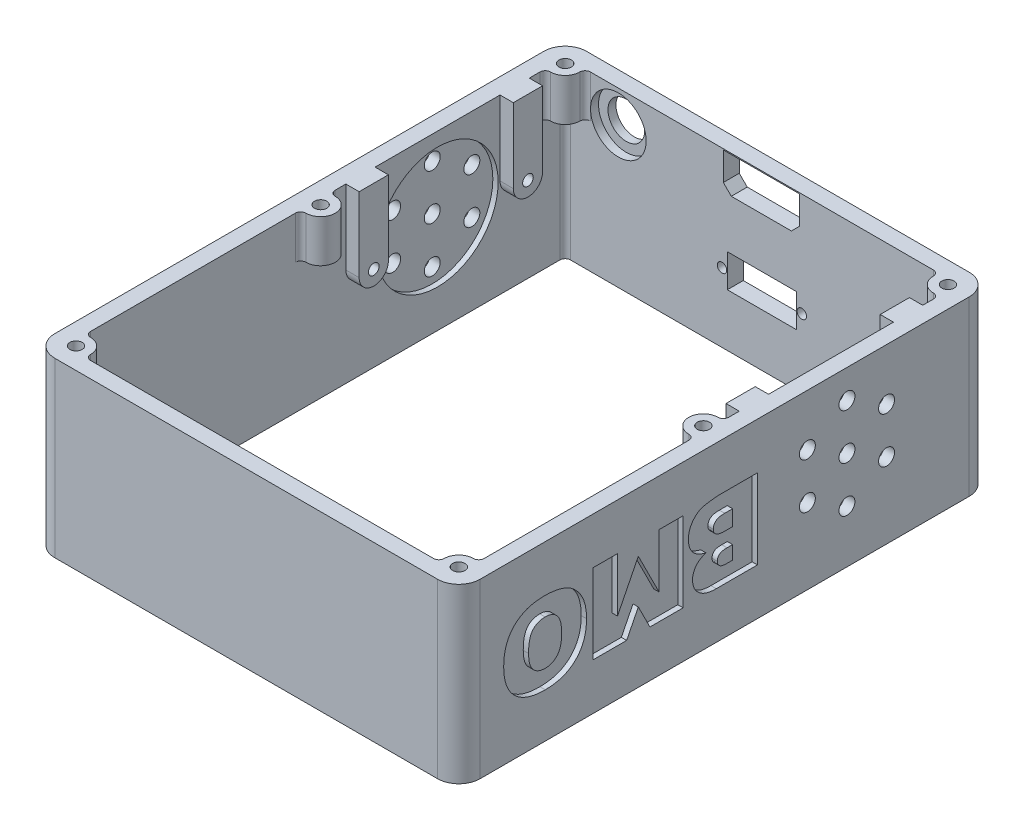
SolidWorks part; units mm, degrees
ref_plane "Front Plane" through (0, 0, 0) normal (0, 0, 1) x (1, 0, 0)
ref_plane "Top Plane" through (0, 0, 0) normal (0, 1, 0) x (1, 0, 0)
ref_plane "Right Plane" through (0, 0, 0) normal (1, 0, 0) x (0, 0, -1)
sketch "Sketch1" plane through (0, 0, 0) normal (0, 1, 0) x (1, 0, 0)
  line L0 (-46.99, 58.42) -> (-46.99, -58.42)
  line L1 (-45.72, -59.69) -> (45.72, -59.69)
  line L2 (46.99, -58.42) -> (46.99, 58.42)
  line L3 (45.72, 59.69) -> (-45.72, 59.69)
  line L4 (45.72, 63.5) -> (-45.72, 63.5)
  line L5 (-50.8, 58.42) -> (-50.8, -58.42)
  line L6 (-45.72, -63.5) -> (45.72, -63.5)
  line L7 (50.8, -58.42) -> (50.8, 58.42)
  line L8 (45.72, 63.5) -> (-45.72, 63.5)
  line L9 (-50.8, 58.42) -> (-50.8, -58.42)
  line L10 (-45.72, -63.5) -> (45.72, -63.5)
  line L11 (50.8, -58.42) -> (50.8, 58.42)
  arc A0 (-45.72, 59.69) -> (-46.99, 58.42) centre (-45.72, 58.42) ccw
  arc A1 (-46.99, -58.42) -> (-45.72, -59.69) centre (-45.72, -58.42) ccw
  arc A2 (45.72, -59.69) -> (46.99, -58.42) centre (45.72, -58.42) ccw
  arc A3 (46.99, 58.42) -> (45.72, 59.69) centre (45.72, 58.42) ccw
  arc A4 (50.8, 58.42) -> (45.72, 63.5) centre (45.72, 58.42) ccw
  arc A5 (-45.72, 63.5) -> (-50.8, 58.42) centre (-45.72, 58.42) ccw
  arc A6 (-50.8, -58.42) -> (-45.72, -63.5) centre (-45.72, -58.42) ccw
  arc A7 (45.72, -63.5) -> (50.8, -58.42) centre (45.72, -58.42) ccw
  arc A8 (50.8, 58.42) -> (45.72, 63.5) centre (45.72, 58.42) ccw
  arc A9 (-45.72, 63.5) -> (-50.8, 58.42) centre (-45.72, 58.42) ccw
  arc A10 (-50.8, -58.42) -> (-45.72, -63.5) centre (-45.72, -58.42) ccw
  arc A11 (45.72, -63.5) -> (50.8, -58.42) centre (45.72, -58.42) ccw
  dimension "D1" = 0
  dimension "D2" = 3.81
extrude "Boss-Extrude1" add sketch "Sketch1" along normal blind 41.275
sketch "Sketch2" plane through (0, 41.275, 0) normal (0, 1, 0) x (1, 0, 0)
  circle A0 centre (-45.72, 58.42) radius 3.4925
  circle A1 centre (45.72, 58.42) radius 3.4925
  circle A2 centre (-45.72, -58.42) radius 3.4925
  circle A3 centre (45.72, -58.42) radius 3.4925
  circle A4 centre (-45.72, 0) radius 3.4925
  circle A5 centre (45.72, 0) radius 3.4925
  dimension "D1" = 6.985
extrude "Boss-Extrude2" add sketch "Sketch2" against normal blind 10.16
hole_wizard "#4 Clearance Hole1" positions "Sketch4" profile "Sketch3" hole size "#4" standard "ANSI Inch"
sketch "Sketch4" plane through (0, 41.275, 0) normal (0, 1, 0) x (1, 0, 0)
  point P0 (-45.72, 58.42)
  point P3 (45.72, 58.42)
  point P6 (-45.72, 0)
  point P9 (45.72, 0)
  point P12 (-45.72, -58.42)
  point P15 (45.72, -58.42)
sketch "Sketch3" plane through (-45.72, 41.275, -58.42) normal (1, 0, 0) x (0, 0, 1)
  line L0 (0, 0) -> (0, 8.5052)
  line L1 (0, 8.5052) -> (1.4732, 7.62)
  line L2 (1.4732, 7.62) -> (1.4732, 0)
  line L5 (1.4732, 0) -> (0, 0)
  line L10 (0, 8.5052) -> (-1.4732, 7.62) construction
  line L11 (0, -6.35) -> (0, 107.95) construction
  dimension "Hole Dia." = 2.9464
  dimension "Hole Depth" = 7.62
  dimension "Drill Angle" = 118
fillet "Fillet1" radius 1.27 12 edges at (46.99, 36.195, -55.1666) (42.4666, 36.195, -59.69) (-42.4666, 36.195, -59.69) (-46.99, 36.195, -55.1666) (-46.99, 36.195, -3.2534) (-46.99, 36.195, 3.2534) (-46.99, 36.195, 55.1666) (-42.4666, 36.195, 59.69) (42.4666, 36.195, 59.69) (46.99, 36.195, 55.1666) (46.99, 36.195, 3.2534) (46.99, 36.195, -3.2534)
sketch "Sketch5" plane through (-46.99, 0, 0) normal (1, 0, 0) x (0, 0, -1)
  circle A2 centre (29.21, 23.495) radius 14.478
  circle A3 centre (29.21, 23.495) radius 14.478
  dimension "D1" = 0.508
extrude "Cut-Extrude1" cut sketch "Sketch5" against normal blind 1.27
sketch "Sketch6" plane through (-46.99, 0, 0) normal (1, 0, 0) x (0, 0, -1)
  line L0 (29.21, 23.495) -> (29.21, 41.275) construction
  line L1 (53.6575, 41.275) -> (4.7625, 41.275) construction
  line L2 (10.795, 41.275) -> (10.795, 23.495) construction
  line L3 (7.3025, 41.275) -> (14.2875, 41.275)
  line L4 (7.3025, 41.275) -> (7.3025, 23.495)
  line L5 (7.3025, 41.275) -> (7.3025, 23.495)
  line L6 (14.2875, 41.275) -> (14.2875, 23.495)
  line L7 (14.2875, 41.275) -> (14.2875, 23.495)
  line L8 (7.3025, 41.275) -> (7.3025, 23.495)
  line L9 (7.3025, 41.275) -> (7.3025, 23.495)
  line L10 (14.2875, 41.275) -> (14.2875, 23.495)
  line L11 (14.2875, 41.275) -> (14.2875, 23.495)
  line L12 (51.1175, 41.275) -> (51.1175, 23.495)
  line L13 (51.1175, 41.275) -> (44.1325, 41.275)
  line L14 (44.1325, 41.275) -> (44.1325, 23.495)
  arc A0 (7.3025, 23.495) -> (14.2875, 23.495) centre (10.795, 23.495) ccw
  arc A1 (51.1175, 23.495) -> (44.1325, 23.495) centre (47.625, 23.495) cw
  dimension "D1" = 6.985
  dimension "D2" = 18.415
extrude "Boss-Extrude3" add sketch "Sketch6" along normal blind 3.175 contours A1 L12 L14 M4 | L4 A0 L6 M4
hole_wizard "#4 Clearance Hole2" positions "Sketch8" profile "Sketch7" hole size "#4" standard "ANSI Inch"
sketch "Sketch8" plane through (-43.815, 0, 0) normal (1, 0, 0) x (0, 0, -1)
  point P0 (10.795, 23.495)
  point P3 (47.625, 23.495)
sketch "Sketch7" plane through (-43.815, 23.495, -10.795) normal (0, 1, 0) x (0, 0, -1)
  line L0 (0, 0) -> (0, 5.8431)
  line L1 (0, 5.8431) -> (1.27, 5.08)
  line L2 (1.27, 5.08) -> (1.27, 0)
  line L5 (1.27, 0) -> (0, 0)
  line L10 (0, 5.8431) -> (-1.27, 5.08) construction
  line L11 (0, -6.35) -> (0, 107.95) construction
  dimension "Hole Dia." = 2.54
  dimension "Hole Depth" = 5.08
  dimension "Drill Angle" = 118
mirror "Mirror2" about plane through (0, 0, 0) normal (1, 0, 0) of "#4 Clearance Hole2", "Boss-Extrude3", "Cut-Extrude1"
sketch "Sketch13" plane through (0, 0, -63.5) normal (0, 0, -1) x (-1, 0, 0)
  line L0 (9.211, 41.275) -> (9.211, 43.18) construction
  line L1 (9.211, 41.021) -> (-8.95, 41.021)
  line L2 (9.211, 41.021) -> (9.211, 32.385)
  line L3 (9.211, 32.385) -> (-8.95, 32.385)
  line L4 (-8.95, 41.021) -> (-8.95, 32.385)
  line L5 (-8.95, 41.275) -> (-8.95, 43.18) construction
  line L6 (-45.72, 41.275) -> (45.72, 41.275) construction
  dimension "D1" = 8.89
  dimension "D2" = 0.254
extrude "Cut-Extrude7" cut sketch "Sketch13" against normal up to surface (3.81 mm away)
chamfer "Chamfer3" distance 1.905 angle 45 2 edges at (-9.211, 32.385, -61.595) (8.95, 32.385, -61.595)
sketch "Sketch14" plane through (-50.8, 0, 0) normal (-1, 0, 0) x (0, 0, 1)
  circle A0 centre (-29.21, 23.495) radius 1.905
  circle A1 centre (-29.21, 34.417) radius 1.905
  circle A2 centre (-19.7513, 28.956) radius 1.905
  circle A3 centre (-19.7513, 18.034) radius 1.905
  circle A4 centre (-29.21, 12.573) radius 1.905
  circle A5 centre (-38.6687, 18.034) radius 1.905
  circle A6 centre (-38.6687, 28.956) radius 1.905
  point P19 (-29.21, 23.495)
  dimension "D1" = 3.81
  dimension "D2" = 6
extrude "Cut-Extrude8" cut sketch "Sketch14" against normal up to surface (97.79 mm away)
mirror "Mirror3" about plane through (0, 0, 0) normal (1, 0, 0) of "Cut-Extrude8"
sketch "Sketch15" plane through (-50.8, 0, 0) normal (-1, 0, 0) x (0, 0, 1)
  line L0 (-58.42, 41.275) -> (-58.42, 0) construction
  point P0 (-7.832, 20.6375)
  point P3 (-58.42, 20.6375)
sketch_block_instance "BMO Logo-1"
sketch_block "BMO Logo"
extrude "Cut-Extrude9" cut sketch "Sketch15" against normal blind 1.27
sketch "Sketch16" plane through (50.8, 0, 0) normal (1, 0, 0) x (0, 0, -1)
  line L1 (58.42, 41.275) -> (58.42, 0) construction
  point P0 (7.8321, 20.6375)
  point P3 (58.42, 20.6375)
sketch_block_instance "BMO Logo-3"
extrude "Cut-Extrude10" cut sketch "Sketch16" against normal blind 1.27
sketch "Sketch17" plane through (0, 0, -59.69) normal (0, 0, 1) x (1, 0, 0)
  circle A2 centre (-34.29, 33.655) radius 6.6421
  circle A3 centre (-34.29, 33.655) radius 6.6421
  dimension "D1" = 1.27
extrude "Cut-Extrude11" cut sketch "Sketch17" against normal blind 1.905
sketch "Sketch18" plane through (0, 0, -63.5) normal (0, 0, -1) x (-1, 0, 0)
  circle A2 centre (34.29, 33.655) radius 4.3815
  circle A3 centre (34.29, 33.655) radius 4.3815
  dimension "D1" = 0.508
extrude "Cut-Extrude12" cut sketch "Sketch18" against normal up to surface (3.81 mm away)
sketch "Sketch19" plane through (0, 0, -59.69) normal (0, 0, 1) x (1, 0, 0)
  line L0 (45.72, 0) -> (-45.72, 0) construction
  line L1 (-8.255, 20.447) -> (8.255, 20.447)
  line L2 (-8.255, 20.447) -> (-8.255, 12.573)
  line L3 (-8.255, 12.573) -> (8.255, 12.573)
  line L4 (8.255, 20.447) -> (8.255, 12.573)
  line L5 (-8.255, 20.447) -> (8.255, 12.573) construction
  line L6 (-8.255, 12.573) -> (8.255, 20.447) construction
  point P0 (0, 16.51)
  dimension "D1" = 16.51
  dimension "D2" = 7.874
  dimension "D3" = 16.51
extrude "Cut-Extrude13" cut sketch "Sketch19" against normal up to surface (3.81 mm away)
hole_wizard "#2 Clearance Hole1" positions "Sketch21" profile "Sketch20" hole size "#2" standard "ANSI Inch"
sketch "Sketch21" plane through (0, 0, -63.5) normal (0, 0, -1) x (-1, 0, 0)
  line L0 (-8.255, 20.447) -> (-8.255, 12.573) construction
  line L1 (0, 0) -> (0, 20.447) construction
  line L2 (8.255, 20.447) -> (-8.255, 20.447) construction
  point P0 (-9.525, 16.51)
  point P2 (9.525, 16.51)
  point P7 (-8.255, 16.51)
  dimension "D1" = 19.05
sketch "Sketch20" plane through (9.525, 16.51, -63.5) normal (1, 0, 0) x (0, 1, 0)
  line L0 (0, 0) -> (0, 7.0292)
  line L1 (0, 7.0292) -> (1.1303, 6.35)
  line L2 (1.1303, 6.35) -> (1.1303, 0)
  line L5 (1.1303, 0) -> (0, 0)
  line L10 (0, 7.0292) -> (-1.1303, 6.35) construction
  line L11 (0, -6.35) -> (0, 107.95) construction
  dimension "Hole Dia." = 2.2606
  dimension "Hole Depth" = 6.35
  dimension "Drill Angle" = 118
sketch "Sketch22" plane through (0, 41.275, 0) normal (0, 1, 0) x (1, 0, 0)
  line L0 (-49.3121, 62.0121) -> (-58.2924, 70.9924) construction
  line L1 (0, 0) -> (0, 63.5) construction
  line L2 (45.72, 63.5) -> (-45.72, 63.5) construction
  line L3 (0, 0) -> (50.8, 0)
  line L4 (-50.8, 58.1118) -> (-60.9864, 68.2983)
  line L5 (-45.4118, 63.5) -> (-55.5983, 73.6864)
  line L6 (-55.5983, 73.6864) -> (-60.9864, 68.2983)
  line L7 (-50.8, 58.42) -> (-50.8, 58.1118)
  line L8 (-45.72, 63.5) -> (-45.4118, 63.5)
  line L9 (-43.0259, 61.1141) -> (-55.5983, 73.6864) construction
  line L10 (-45.72, 58.42) -> (-58.2924, 70.9924) construction
  line L11 (-48.4141, 55.7259) -> (-60.9864, 68.2983) construction
  arc A0 (-45.72, 63.5) -> (-50.8, 58.42) centre (-45.72, 58.42) ccw construction
  arc A1 (-45.72, 63.5) -> (-50.8, 58.42) centre (-45.72, 58.42) ccw
  dimension "D1" = 45
  dimension "D2" = 17.78
  dimension "D3" = 3.81
  dimension "D4" = 3.81
extrude "Boss-Extrude4" [suppressed] add sketch "Sketch22" against normal blind 1.27 contours A1 L8 L5 L6 L4 L7
mirror "Mirror4" [suppressed] about plane through (0, 0, 0) normal (1, 0, 0)
mirror "Mirror5" [suppressed] about plane through (0, 0, 0) normal (0, 0, 1)
